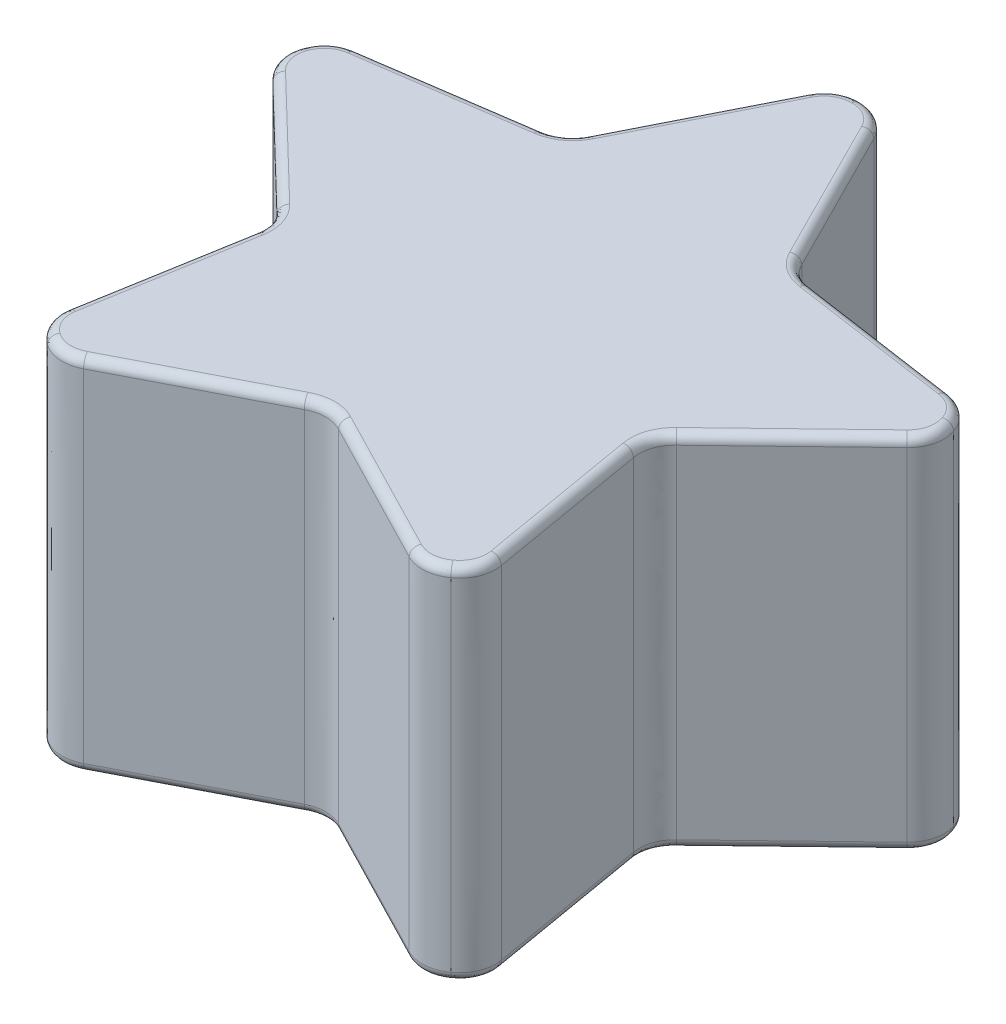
SolidWorks part; units mm, degrees
ref_plane "Front Plane" through (0, 0, 0) normal (0, 0, 1) x (1, 0, 0)
ref_plane "Top Plane" through (0, 0, 0) normal (0, 1, 0) x (1, 0, 0)
ref_plane "Right Plane" through (0, 0, 0) normal (1, 0, 0) x (0, 0, -1)
body saved out of another part "Stock-Wooden Clock Video-1"
fillet "Fillet1" radius 0.5 50 edges
